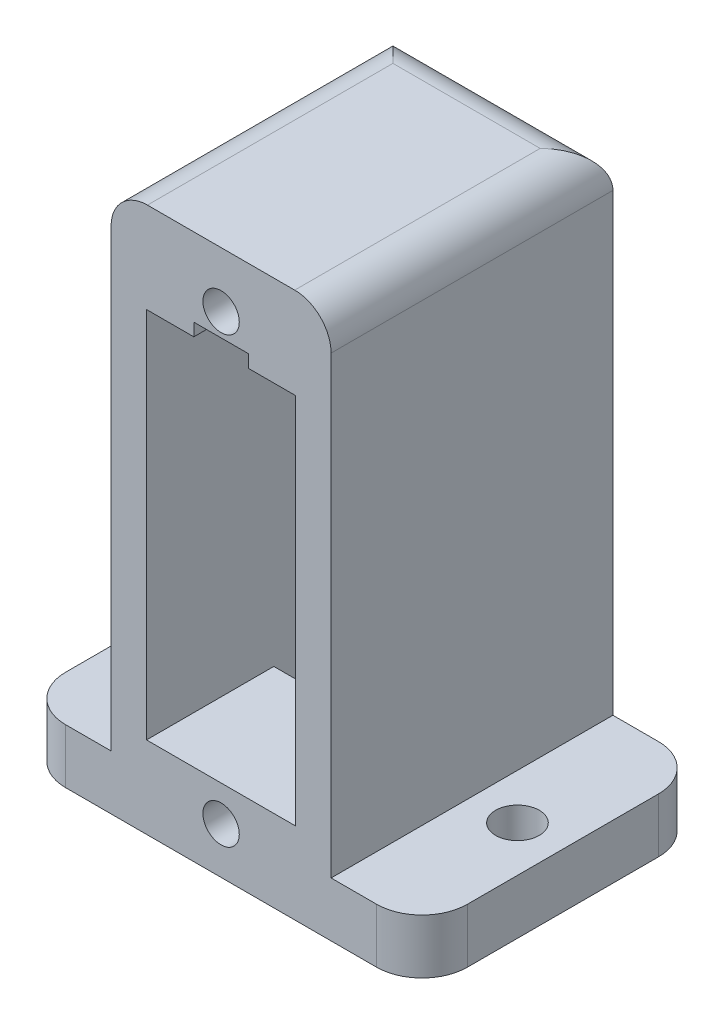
SolidWorks part; units mm, degrees
ref_plane "Plan de face" through (0, 0, 0) normal (0, 0, 1) x (1, 0, 0)
ref_plane "Plan de dessus" through (0, 0, 0) normal (0, 1, 0) x (1, 0, 0)
ref_plane "Plan de droite" through (0, 0, 0) normal (1, 0, 0) x (0, 0, -1)
sketch "Esquisse1" plane through (0, 0, 0) normal (0, 0, 1) x (1, 0, 0)
  line L1 (0, 0) -> (12.1, 0)
  line L2 (0, 0) -> (0, 30)
  line L3 (0, 30) -> (12.1, 30)
  line L4 (12.1, 0) -> (12.1, 30)
extrude "Boss.-Extru.1" add sketch "Esquisse1" along normal blind 15.5
sketch "Esquisse2" plane through (0, 0, 15.5) normal (0, 0, 1) x (1, 0, 0)
  line L0 (16.024, 30) -> (6.05, 30) construction
  line L1 (16.024, 25) -> (0.653, 25) construction
  line L2 (16.024, 4.5) -> (0.653, 4.5) construction
  line L3 (12.1, 30) -> (0, 30) construction
  line L4 (6.05, 30) -> (6.05, -3.1225) construction
  line L5 (1.95, 26.5711) -> (1.95, -6.3196) construction
  line L6 (10.15, 26.5711) -> (10.15, -6.3196) construction
  line L7 (13.1702, 26.95) -> (-6.9322, 26.95) construction
  line L8 (1.95, 25) -> (4.55, 25)
  line L9 (1.95, 25) -> (1.95, 4.5)
  line L10 (1.95, 4.5) -> (10.15, 4.5)
  line L11 (10.15, 25) -> (10.15, 4.5)
  line L12 (7.2577, 3.45) -> (-6.9322, 3.45) construction
  line L13 (1.95, 14.75) -> (-3.8664, 14.75) construction
  line L14 (7.55, 25) -> (10.15, 25)
  line L15 (7.55, 25.7) -> (4.55, 25.7)
  line L16 (7.55, 25.7) -> (7.55, 25)
  line L18 (4.55, 25.7) -> (4.55, 25)
  line L19 (7.55, 25.7) -> (4.55, 25) construction
  line L20 (7.55, 25) -> (4.55, 25.7) construction
  circle A0 centre (6.05, 26.95) radius 1
  circle A1 centre (6.05, 2.55) radius 1
  point P27 (6.05, 4.7)
  point P28 (6.05, 25.35)
  dimension "D1" = 5
  dimension "D2" = 20.5
  dimension "D3" = 8.2
  dimension "D4" = 4.1
  dimension "D5" = 11.3
  dimension "D6" = 23.5
extrude "Enlèv. mat.-Extru.1" cut sketch "Esquisse2" against normal blind 13.5
sketch "Esquisse3" plane through (0, 0, 0) normal (0, -1, 0) x (1, 0, 0)
  line L0 (-4.173, 15.5) -> (6.05, 15.5) construction
  line L1 (0, 15.5) -> (12.1, 15.5) construction
  line L2 (-4.173, 8.5) -> (10.7176, 8.5) construction
  line L3 (6.05, 15.5) -> (6.05, 4.894) construction
  line L4 (1.95, 19.697) -> (1.95, -1.6754) construction
  line L5 (10.15, 19.697) -> (10.15, -1.6754) construction
  line L8 (1.95, 8.5) -> (10.15, 8.5)
  line L9 (1.95, 8.5) -> (1.95, 0)
  line L10 (1.95, 0) -> (10.15, 0)
  line L11 (10.15, 8.5) -> (10.15, 0)
  dimension "D1" = 8.2
  dimension "D2" = 4.1
  dimension "D3" = 7
extrude "Enlèv. mat.-Extru.2" cut sketch "Esquisse3" against normal blind 4.5
fillet "Congé1" radius 2 3 edges at (6.05, 30, 0) (0, 30, 7.75) (12.1, 30, 7.75)
sketch "Esquisse4" plane through (0, 0, 0) normal (0, -1, 0) x (1, 0, 0)
  line L0 (10.15, 0) -> (12.1, 0) construction
  line L1 (6.05, 8.5) -> (6.05, 13.4585) construction
  line L2 (10.15, 8.5) -> (1.95, 8.5) construction
  line L3 (17.1, 15.9035) -> (17.1, 0.9462) construction
  line L4 (14.6, -1.1557) -> (14.6, 15.9035) construction
  line L5 (12.1, 15.5) -> (12.1, 0) construction
  line L6 (11.125, 0) -> (18.308, 0) construction
  line L7 (0, 15.5) -> (12.1, 15.5) construction
  line L8 (14.6, 0) -> (11.4966, 0)
  line L9 (17.1, 2.5) -> (17.1, 13)
  line L10 (14.6, 15.5) -> (11.4966, 15.5)
  line L11 (11.4966, 0) -> (11.4966, 15.5)
  line L12 (-2.5, 15.5) -> (0.6034, 15.5)
  line L13 (-5, 2.5) -> (-5, 13)
  line L14 (0.6034, 0) -> (0.6034, 15.5)
  line L15 (-2.5, 0) -> (0.6034, 0)
  circle A0 centre (14.6, 7.75) radius 1.2
  arc A1 (14.6, 0) -> (17.1, 2.5) centre (14.6, 2.5) ccw
  arc A2 (17.1, 13) -> (14.6, 15.5) centre (14.6, 13) ccw
  circle A3 centre (-2.5, 7.75) radius 1.2
  arc A4 (-5, 13) -> (-2.5, 15.5) centre (-2.5, 13) cw
  arc A5 (-2.5, 0) -> (-5, 2.5) centre (-2.5, 2.5) cw
  point P26 (17.1, 0)
  dimension "D1" = 2.5
  dimension "D3" = 2.5
  dimension "D4" = 7.75
  dimension "D2" = 2.5
extrude "Boss.-Extru.2" add sketch "Esquisse4" against normal blind 3
